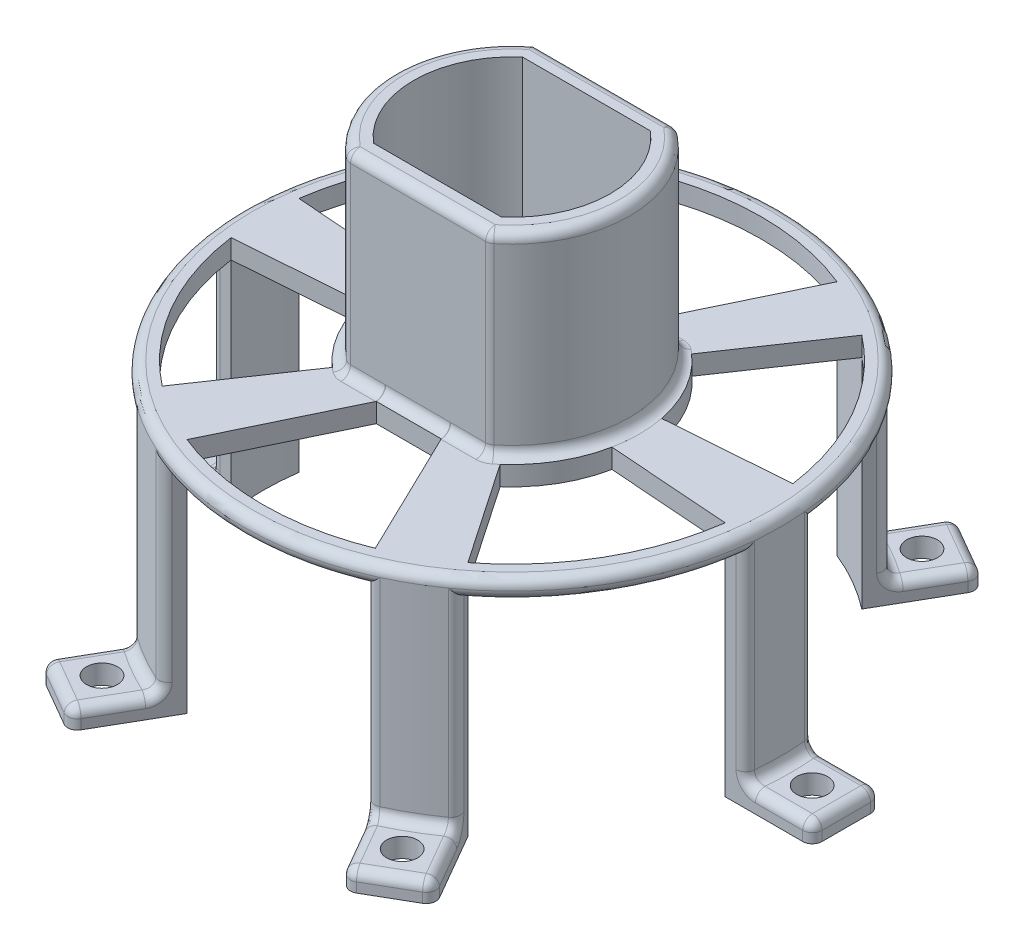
SolidWorks part; units mm, degrees
ref_plane "Front Plane" through (0, 0, 0) normal (0, 0, 1) x (1, 0, 0)
ref_plane "Top Plane" through (0, 0, 0) normal (0, 1, 0) x (1, 0, 0)
ref_plane "Right Plane" through (0, 0, 0) normal (1, 0, 0) x (0, 0, -1)
sketch "Sketch1" plane through (0, 0, 0) normal (0, 1, 0) x (1, 0, 0)
  line L0 (-27.5284, 3.5) -> (-25.511, 3.5)
  line L3 (-27.5284, -3.5) -> (-25.511, -3.5)
  line L4 (0, 0) -> (-46.6352, 0) construction
  line L5 (-55, 0) -> (55, 0) construction
  arc A0 (-25.511, 3.5) -> (-25.511, -3.5) centre (0, 0) ccw
  arc A2 (-27.5284, 3.5) -> (-27.5284, -3.5) centre (0, 0) ccw
  dimension "D1" = 51.5
  dimension "D2" = 2
extrude "Boss-Extrude1" add sketch "Sketch1" along normal blind 22.5
sketch "Sketch2" plane through (0, 0, 0) normal (0, -1, 0) x (1, 0, 0)
  line L0 (-27.5284, 3.5) -> (-34.5284, 3.5)
  line L1 (-34.5284, 3.5) -> (-34.5284, -3.5)
  line L2 (-34.5284, -3.5) -> (-27.5284, -3.5)
  line L3 (0, 0) -> (-47.6393, 0) construction
  line L4 (55, 0) -> (-55, 0) construction
  line L5 (-31, 3.5) -> (-31, -3.5) construction
  circle A0 centre (0, 0) radius 27.75 construction
  circle A1 centre (-31, 0) radius 1.6
  point P15 (-31.3632, 0)
  dimension "D3" = 3.2
  dimension "D1" = 7
  dimension "D2" = 7
  dimension "D4" = 31
extrude "Boss-Extrude2" add sketch "Sketch2" against normal blind 2 contours L1 L2 L0 A1 M5
sketch "Sketch3" plane through (0, 0, 0) normal (0, 0, 1) x (1, 0, 0)
  line L0 (0, 0) -> (0, 32.8576) construction
  line L1 (0, -11.825) -> (0, 11.825) construction
sketch "Sketch7" plane through (0, 22.5, 0) normal (0, 1, 0) x (1, 0, 0)
  line L0 (-25.511, 3.5) -> (-12.8955, 2.5748)
  line L1 (-25.511, -3.5) -> (-12.899, -2.557)
  line L2 (-15.7866, 20.3432) -> (-8.6639, 9.8924)
  line L3 (-9.7244, 23.8432) -> (-3.345, 10.65)
  line L4 (9.7244, 23.8432) -> (3.3681, 10.65)
  line L5 (15.7866, 20.3432) -> (8.6776, 9.8804)
  line L6 (25.511, 3.5) -> (12.899, 2.557)
  line L7 (25.511, -3.5) -> (12.8955, -2.5748)
  line L8 (15.7866, -20.3432) -> (8.6639, -9.8924)
  line L9 (9.7244, -23.8432) -> (3.345, -10.65)
  line L10 (-9.7244, -23.8432) -> (-3.3681, -10.65)
  line L11 (-15.7866, -20.3432) -> (-8.6776, -9.8804)
  line L12 (-1.4109, 6.65) -> (1.441, 6.65)
  line L13 (-1.441, -6.65) -> (1.4109, -6.65)
  line L14 (0, 0) -> (36.8252, 0) construction
  line L15 (-55, 0) -> (55, 0) construction
  line L16 (-3.345, 10.65) -> (3.3681, 10.65)
  line L17 (-3.3681, -10.65) -> (3.345, -10.65)
  line L18 (-8.8676, -2.2556) -> (-3.2093, -1.8325)
  line L19 (-6.4044, -6.5349) -> (-3.2093, -1.8325)
  line L20 (-6.3872, 6.5518) -> (-3.1917, 1.8631)
  line L21 (-8.8617, 2.2789) -> (-3.1917, 1.8631)
  line L22 (-1.4109, 6.65) -> (0.0176, 3.6956)
  line L23 (1.441, 6.65) -> (0.0176, 3.6956)
  line L24 (6.4044, 6.5349) -> (3.2093, 1.8325)
  line L25 (8.8676, 2.2556) -> (3.2093, 1.8325)
  line L26 (8.8617, -2.2789) -> (3.1917, -1.8631)
  line L27 (6.3872, -6.5518) -> (3.1917, -1.8631)
  line L28 (-1.441, -6.65) -> (-0.0176, -3.6956)
  line L29 (1.4109, -6.65) -> (-0.0176, -3.6956)
  circle A0 centre (0, 0) radius 27.75
  circle A1 centre (0, 0) radius 3.15
  arc A2 (-25.511, -3.5) -> (-15.7866, -20.3432) centre (0, 0) ccw
  arc A3 (-15.7866, 20.3432) -> (-25.511, 3.5) centre (0, 0) ccw
  arc A4 (9.7244, 23.8432) -> (-9.7244, 23.8432) centre (0, 0) ccw
  arc A5 (25.511, 3.5) -> (15.7866, 20.3432) centre (0, 0) ccw
  arc A6 (15.7866, -20.3432) -> (25.511, -3.5) centre (0, 0) ccw
  arc A7 (-9.7244, -23.8432) -> (9.7244, -23.8432) centre (0, 0) ccw
  arc A8 (-6.3872, 6.5518) -> (-8.8617, 2.2789) centre (0, 0) ccw
  arc A9 (6.3872, -6.5518) -> (8.8617, -2.2789) centre (0, 0) ccw
  arc A10 (-8.6639, 9.8924) -> (-12.8955, 2.5748) centre (0, 0) ccw
  arc A11 (8.6639, -9.8924) -> (12.8955, -2.5748) centre (0, 0) ccw
  arc A12 (-8.8676, -2.2556) -> (-6.4044, -6.5349) centre (0, 0) ccw
  arc A13 (8.8676, 2.2556) -> (6.4044, 6.5349) centre (0, 0) ccw
  arc A14 (12.899, 2.557) -> (8.6776, 9.8804) centre (0, 0) ccw
  arc A15 (-12.899, -2.557) -> (-8.6776, -9.8804) centre (0, 0) ccw
  point P15 (-6.3872, -6.5518)
  point P21 (6.3595, -6.5787)
  point P23 (0, 0)
  point P25 (-6.3557, 6.5824)
  point P34 (0, 0)
  dimension "D1" = 55.5
  dimension "D2" = 6.3
  dimension "D3" = 18.3
  dimension "D6" = 26.3
  dimension "D4" = 6
  dimension "D5" = 13.3
  dimension "D7" = 21.3
extrude "Boss-Extrude3" add sketch "Sketch7" along normal blind 2
sketch "Sketch8" plane through (0, 24.5, 0) normal (0, 1, 0) x (1, 0, 0)
  line L0 (-6.6131, 7.7) -> (6.6131, 7.7)
  line L1 (-6.6131, -7.7) -> (6.6131, -7.7)
  line L2 (0, 0) -> (43.0032, 0) construction
  line L3 (-7.3166, 9.7) -> (7.3166, 9.7)
  line L4 (-7.3166, -9.7) -> (7.3166, -9.7)
  arc A0 (-6.6131, 7.7) -> (-6.6131, -7.7) centre (0, 0) ccw
  arc A1 (-7.3166, 9.7) -> (-7.3166, -9.7) centre (0, 0) ccw
  arc A3 (6.6131, -7.7) -> (6.6131, 7.7) centre (0, 0) ccw
  arc A4 (7.3166, -9.7) -> (7.3166, 9.7) centre (0, 0) ccw
  dimension "D1" = 20.3
  dimension "D2" = 2
  dimension "D3" = 15.4
  dimension "D4" = 2
extrude "Boss-Extrude4" add sketch "Sketch8" along normal blind 20
pattern_circular "CirPattern1" count 6 over 360 about axis through (0, 0, 0) along (0, 1, 0) of "Boss-Extrude1", "Boss-Extrude2"
fillet "Fillet2" radius 1 66 edges at (-12.15, 44.5, 0) (0, 44.5, 9.7) (12.15, 44.5, 0) (0, 44.5, -9.7) (-12.15, 24.5, 0) (0, 24.5, 9.7) (-7.3166, 34.5, 9.7) (12.15, 24.5, 0) (7.3166, 34.5, 9.7) (0, 24.5, -9.7) (7.3166, 34.5, -9.7) (-24.0322, 22.5, -13.875) (-34.5284, 2, 0) (-10.7331, 12.25, -25.5903) (-16.7953, 12.25, -22.0903) (-34.5284, 1, -3.5) (-31.0284, 2, 3.5) (-34.5284, 1, 3.5) (0, 22.5, -27.75) (16.7953, 12.25, -22.0903) (10.7331, 12.25, -25.5903) (-31.0284, 2, -3.5) (24.0322, 22.5, -13.875) (-27.75, 2, 0) (27.5284, 12.25, 3.5) (27.5284, 12.25, -3.5) (24.0322, 22.5, 13.875) (10.7331, 12.25, 25.5903) (16.7953, 12.25, 22.0903) (0, 22.5, 27.75) (-16.7953, 12.25, 22.0903) (-10.7331, 12.25, 25.5903) (-17.2642, 2, -29.9025) (-14.2331, 1, -31.6525) (-18.5453, 2, -25.1214) (-20.2953, 1, -28.1525) (-12.4831, 2, -28.6214) (-13.875, 2, -24.0322) (17.2642, 2, -29.9025) (20.2953, 1, -28.1525) (12.4831, 2, -28.6214) (14.2331, 1, -31.6525) (18.5453, 2, -25.1214) (13.875, 2, -24.0322) (34.5284, 2, 0) (34.5284, 1, 3.5) (31.0284, 2, -3.5) (34.5284, 1, -3.5) (31.0284, 2, 3.5) (27.75, 2, 0) (17.2642, 2, 29.9025) (14.2331, 1, 31.6525) (18.5453, 2, 25.1214) (20.2953, 1, 28.1525) (12.4831, 2, 28.6214) (13.875, 2, 24.0322) (-17.2642, 2, 29.9025) (-20.2953, 1, 28.1525) (-12.4831, 2, 28.6214) (-14.2331, 1, 31.6525) (-18.5453, 2, 25.1214) (-13.875, 2, 24.0322) (0, 24.5, 27.75) (-24.0322, 22.5, 13.875) (-27.5284, 12.25, 3.5) (-27.5284, 12.25, -3.5)
